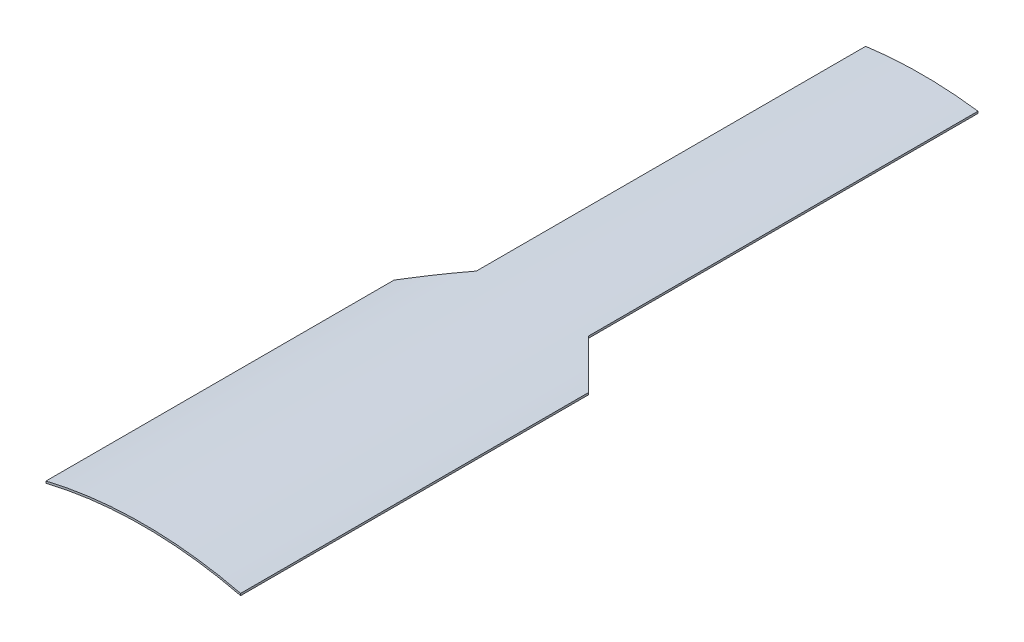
SolidWorks part; units mm, degrees
ref_plane "Front Plane" through (0, 0, 0) normal (0, 0, 1) x (1, 0, 0)
ref_plane "Top Plane" through (0, 0, 0) normal (0, 1, 0) x (1, 0, 0)
ref_plane "Right Plane" through (0, 0, 0) normal (1, 0, 0) x (0, 0, -1)
sketch "Sketch1" plane through (0, 0, 0) normal (0, 0, 1) x (1, 0, 0)
  line L0 (0, 0) -> (0, 29.185) construction
  line L1 (-6.35, 28.4164) -> (6.35, 28.4164) construction
  line L2 (-6.35, 28.4164) -> (-6.35, 23.4882) construction
  line L3 (-6.35, 23.4882) -> (6.35, 23.4882) construction
  line L4 (6.35, 28.4164) -> (6.35, 23.4882) construction
  line L5 (-6.35, 26.2298) -> (-6.35, 26.0991)
  line L6 (6.35, 26.2298) -> (6.35, 26.0991)
  circle A0 centre (0, 0) radius 26.9875 construction
  circle A1 centre (0, 0) radius 26.8605 construction
  arc A2 (-6.35, 26.2298) -> (6.35, 26.2298) centre (0, 0) cw
  arc A3 (6.35, 26.0991) -> (-6.35, 26.0991) centre (0, 0) ccw
  dimension "D1" = 53.975
  dimension "D2" = 53.721
  dimension "D3" = 12.7
  dimension "D4" = 6.35
extrude "Extrude1" add sketch "Sketch1" along normal blind 50.8
sketch "Sketch2" plane through (0, 0, 0) normal (0, 1, 0) x (1, 0, 0)
  line L0 (6.35, 0) -> (-6.35, 0) construction
  line L1 (-3.6654, 0) -> (3.6654, 0)
  line L2 (-3.6654, 0) -> (-3.6654, -25.4)
  line L3 (-6.35, -28.0846) -> (-6.35, 2.0561)
  line L4 (3.6654, 0) -> (3.6654, -25.4)
  line L5 (-3.6654, -25.4) -> (-6.35, -28.0846)
  line L6 (-6.35, -50.8) -> (-6.35, 0) construction
  line L7 (3.6654, -25.4) -> (6.35, -28.0846)
  line L8 (6.35, -50.8) -> (6.35, 0) construction
  line L9 (-6.35, -28.0846) -> (12.6785, -28.0846) construction
  line L10 (-6.35, 2.0561) -> (6.35, 2.0561)
  line L11 (6.35, 2.0561) -> (6.35, -28.0846)
  dimension "D1" = 25.4
  dimension "D2" = 135
  dimension "D3" = 135
extrude "Cut-Extrude1" cut sketch "Sketch2" along normal blind 50.8
